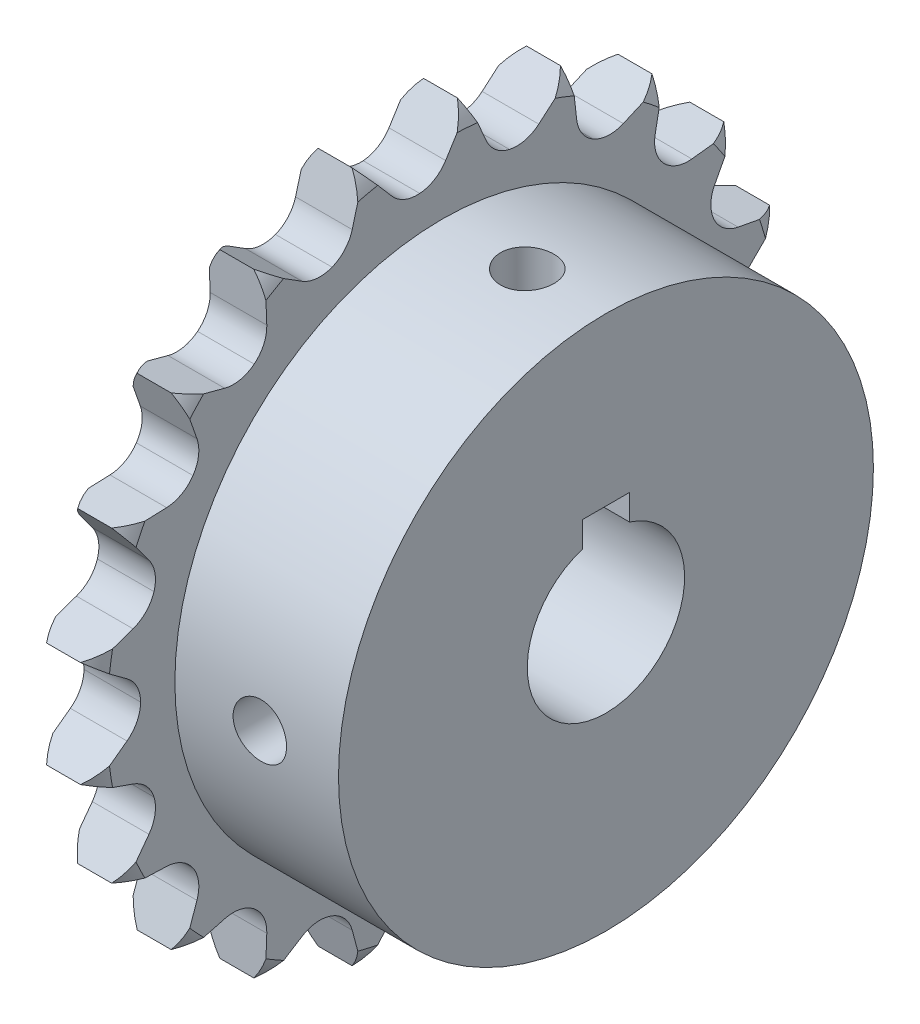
SolidWorks part; units mm, degrees
ref_plane "Plan de face" through (0, 0, 0) normal (0, 0, 1) x (1, 0, 0)
ref_plane "Plan de dessus" through (0, 0, 0) normal (0, 1, 0) x (1, 0, 0)
ref_plane "Plan de droite" through (0, 0, 0) normal (1, 0, 0) x (0, 0, -1)
imported_body "Importée1"
sketch "Esquisse1" plane through (28, 0, 0) normal (1, 0, 0) x (0, 0, -1)
  line L2 (-3, 9.5394) -> (-3, 12.8)
  line L3 (-3, 12.8) -> (3, 12.8)
  line L4 (3, 9.5394) -> (3, 12.8)
  arc A0 (-3, 9.5394) -> (3, 9.5394) centre (0, 0) ccw
  dimension "D1" = 20
  dimension "D4" = 22.8
  dimension "D2" = 3
  dimension "D3" = 6
extrude "Enlèv. mat.-Extru.1" cut sketch "Esquisse1" against normal through all
ref_plane "Plan1" through (3.6, 0, 0) normal (-1, 0, 0) x (0, 0, 1)
sketch "Esquisse3" plane through (3.6, 0, 0) normal (-1, 0, 0) x (0, 0, 1)
  circle A0 centre (0, 0) radius 42.61 construction
  dimension "D1" = 85.22
ref_plane "Plan2" through (17.6, 34, 0) normal (0, 1, 0) x (0, 0, 1)
hole_wizard "Trou taraudé M82" positions "Esquisse5" profile "Esquisse4" tap size "M8" standard "ISO"
sketch "Esquisse5" plane through (17.6, 34, 0) normal (0, 1, 0) x (0, 0, 1)
  line L0 (34, 10.4) -> (-34, 10.4) construction
  point P1 (0, 0.4)
  dimension "D1" = 10
sketch "Esquisse4" plane through (18, 34, 0) normal (1, 0, 0) x (0, 0, 1)
  line L0 (0, 0) -> (0, 68)
  line L1 (0, 68) -> (3.4, 68)
  line L2 (3.4, 68) -> (3.4, 0)
  line L5 (3.4, 0) -> (0, 0)
  line L11 (0, -6.35) -> (0, 107.95) construction
  dimension "Diamètre du trou pour taraudage jusqu'au prochain" = 6.8
  dimension "Profondeur du trou pour taraudage jusqu'au prochain" = 68
pattern_circular "Répétition circulaire1" count 2 every 90 about axis through (0, 0, 0) along (1, 0, 0) of "Trou taraudé M82"
